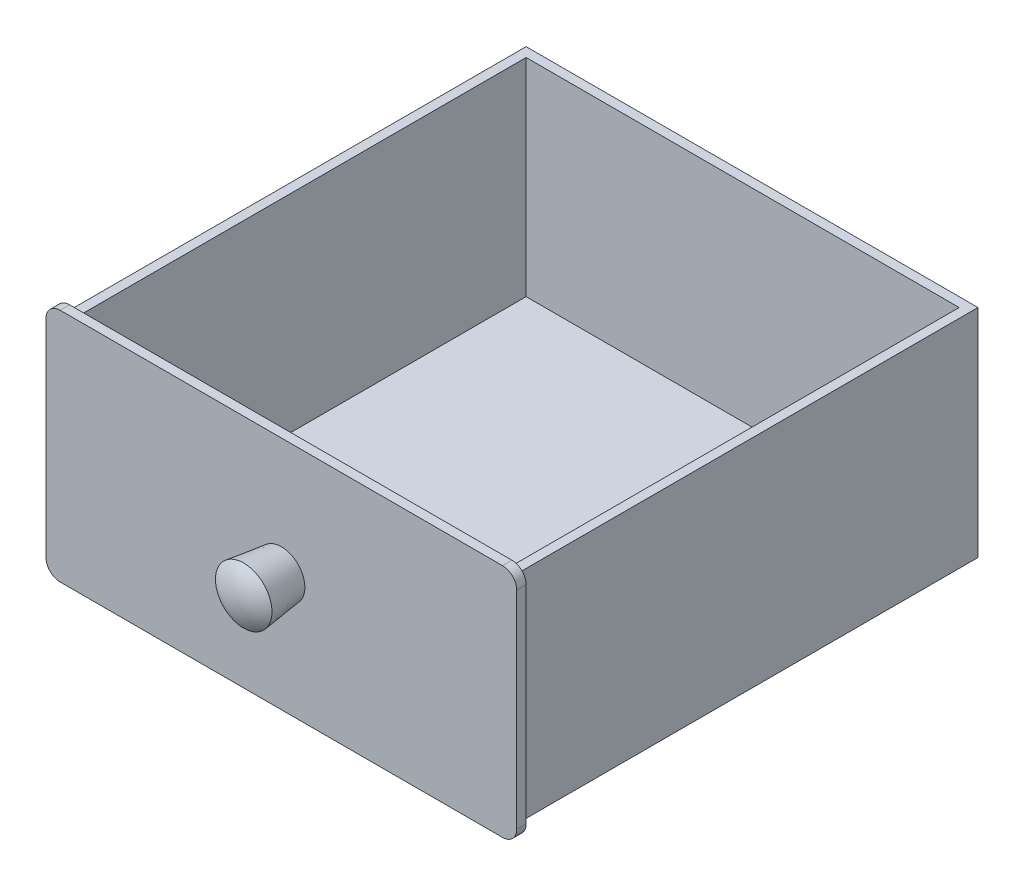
SolidWorks part; units mm, degrees
ref_plane "正面" through (0, 0, 0) normal (0, 0, 1) x (1, 0, 0)
ref_plane "平面" through (0, 0, 0) normal (0, 1, 0) x (1, 0, 0)
ref_plane "右側面" through (0, 0, 0) normal (1, 0, 0) x (0, 0, -1)
sketch "ｽｹｯﾁ1" plane through (0, 0, 0) normal (0, 1, 0) x (1, 0, 0)
  line L1 (-48, -49) -> (48, -49)
  line L2 (-48, -49) -> (-48, 49)
  line L3 (-48, 49) -> (48, 49)
  line L4 (48, -49) -> (48, 49)
  line L5 (-48, -49) -> (48, 49) construction
  line L6 (-48, 49) -> (48, -49) construction
  point P0 (0, 0)
  dimension "D1" = 96
  dimension "D2" = 98
extrude "ﾎﾞｽ - 押し出し1" add sketch "ｽｹｯﾁ1" along normal blind 46
shell "ｼｪﾙ1" thickness 2
sketch "ｽｹｯﾁ2" plane through (0, 0, 49) normal (0, 0, 1) x (1, 0, 0)
  line L0 (48, 46) -> (48, 0) construction
  line L1 (-50, 48) -> (50, 48)
  line L2 (-50, 48) -> (-50, -2)
  line L3 (-50, -2) -> (50, -2)
  line L4 (50, 48) -> (50, -2)
  line L6 (46, 46) -> (48, 46) construction
  line L7 (-48, 0) -> (48, 0) construction
  line L8 (-48, 46) -> (-48, 0) construction
  dimension "D1" = 2
  dimension "D2" = 2
  dimension "D3" = 2
  dimension "D4" = 2
extrude "ﾎﾞｽ - 押し出し2" add sketch "ｽｹｯﾁ2" along normal blind 2
sketch "ｽｹｯﾁ3" plane through (0, 0, 0) normal (1, 0, 0) x (0, 0, -1)
  line L0 (-51, 23) -> (-61, 23)
  line L1 (-51, -2) -> (-51, 48) construction
  line L2 (-51, 23) -> (-51, 28)
  line L3 (-51, 28) -> (-59, 29)
  line L4 (-51, 23) -> (-73.233, 23) construction
  arc A0 (-61, 23) -> (-59, 29) centre (-51, 23) cw
  dimension "D1" = 10
  dimension "D2" = 10
  dimension "D3" = 10
  dimension "D4" = 12
revolve "回転1" add sketch "ｽｹｯﾁ3" angle 360 about L4
fillet "ﾌｨﾚｯﾄ1" radius 3 4 edges at (-50, -2, 50) (-50, 48, 50) (50, -2, 50) (50, 48, 50)
